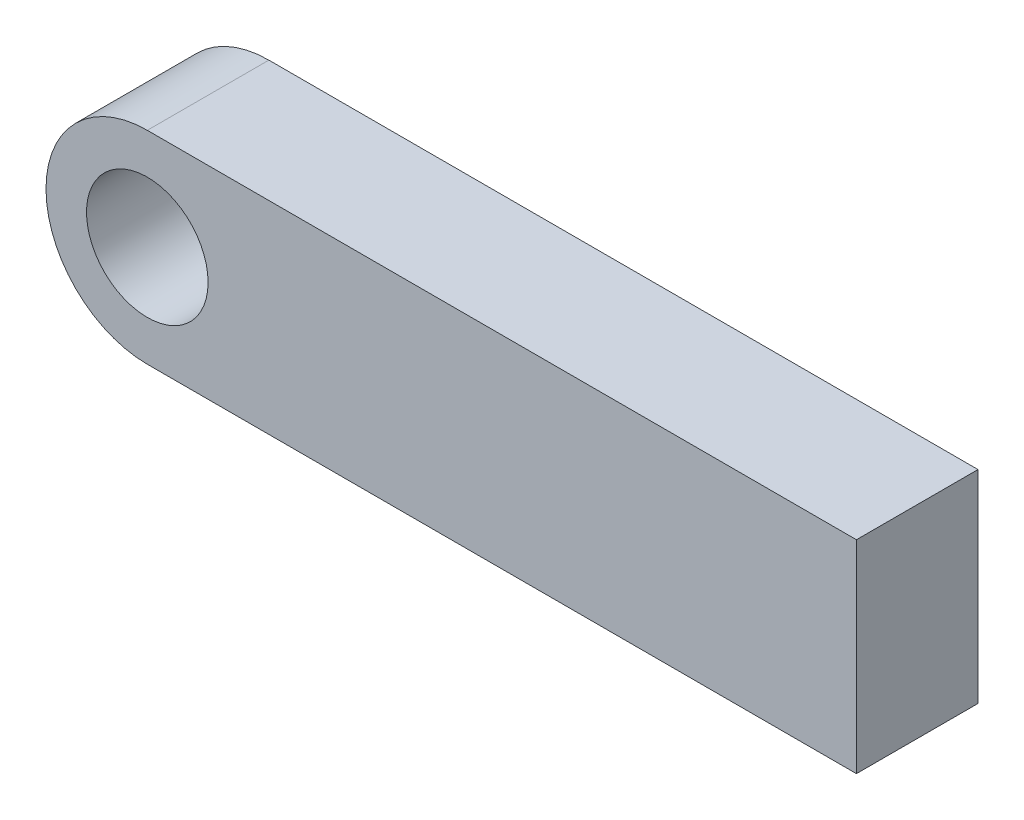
SolidWorks part; units mm, degrees
ref_plane "Front Plane" through (0, 0, 0) normal (0, 0, 1) x (1, 0, 0)
ref_plane "Top Plane" through (0, 0, 0) normal (0, 1, 0) x (1, 0, 0)
ref_plane "Right Plane" through (0, 0, 0) normal (1, 0, 0) x (0, 0, -1)
sketch "Sketch1" plane through (0, 0, 0) normal (0, 0, 1) x (1, 0, 0)
  line L0 (0, 0) -> (35, 0) construction
  line L1 (0, -5) -> (35, -5)
  line L2 (0, 5) -> (35, 5)
  line L3 (35, 5) -> (35, -5)
  arc A0 (0, -5) -> (0, 5) centre (0, 0) cw
  circle A2 centre (0, 0) radius 3
  dimension "D4" = 6
  dimension "D3" = 35
  dimension "D1" = 5
  dimension "D2" = 5
extrude "Extrude1" add sketch "Sketch1" along normal mid plane 6
